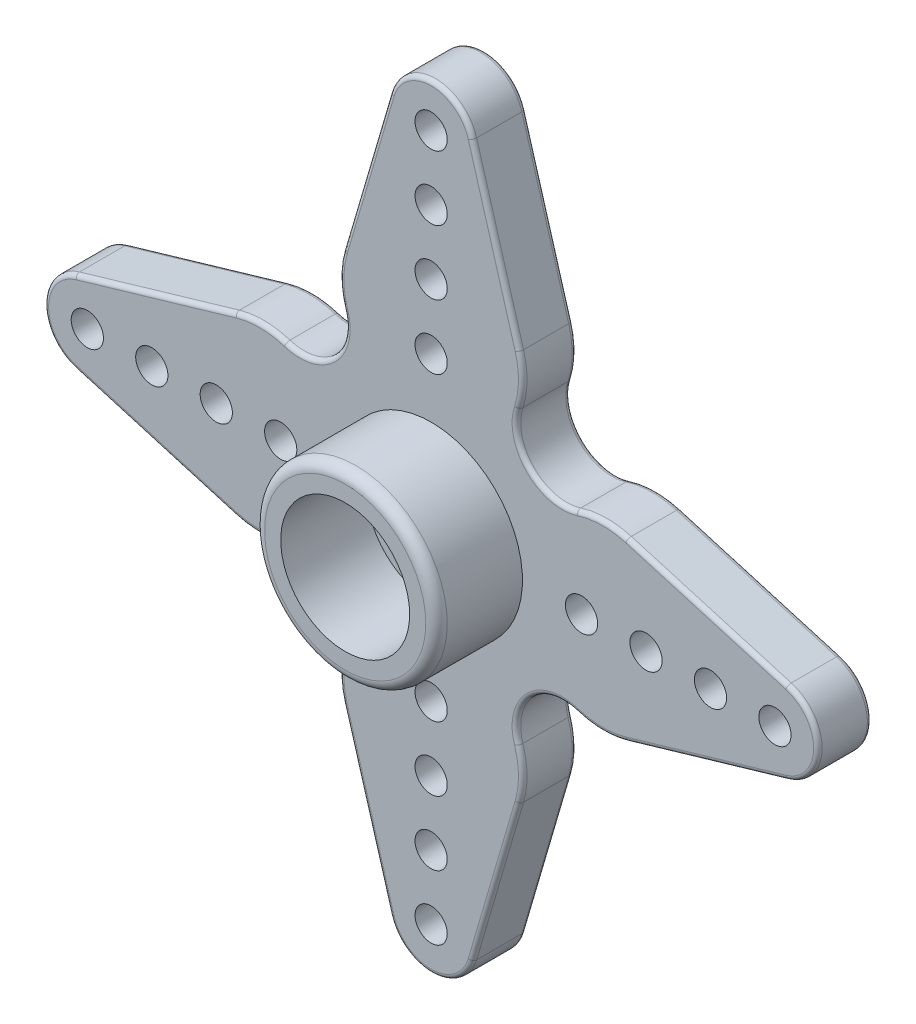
SolidWorks part; units mm, degrees
ref_plane "Front Plane" through (0, 0, 0) normal (0, 0, 1) x (1, 0, 0)
ref_plane "Top Plane" through (0, 0, 0) normal (0, 1, 0) x (1, 0, 0)
ref_plane "Right Plane" through (0, 0, 0) normal (1, 0, 0) x (0, 0, -1)
sketch "Sketch1" plane through (0, 0, 0) normal (0, 0, 1) x (1, 0, 0)
  line L0 (0, 18) -> (0, -18) construction
  line L1 (-18, 18) -> (18, 18) construction
  line L2 (-18, 18) -> (-18, -18) construction
  line L3 (-18, -18) -> (18, -18) construction
  line L4 (18, 18) -> (18, -18) construction
  line L5 (1.9193, 16.5625) -> (4.1016, 9.1164)
  line L6 (-1.9193, 16.5625) -> (-4.1016, 9.1164)
  line L7 (16.5625, 1.9193) -> (9.1164, 4.1016)
  line L8 (16.5625, -1.9193) -> (9.1164, -4.1016)
  line L9 (1.9193, -16.5625) -> (4.1016, -9.1164)
  line L10 (-1.9193, -16.5625) -> (-4.1016, -9.1164)
  line L11 (-16.5625, -1.9193) -> (-9.1164, -4.1016)
  line L12 (-16.5625, 1.9193) -> (-9.1164, 4.1016)
  arc A0 (1.9193, 16.5625) -> (-1.9193, 16.5625) centre (0, 16) ccw
  arc A1 (16.5625, -1.9193) -> (16.5625, 1.9193) centre (16, 0) ccw
  arc A2 (-1.9193, -16.5625) -> (1.9193, -16.5625) centre (0, -16) ccw
  arc A3 (-16.5625, 1.9193) -> (-16.5625, -1.9193) centre (-16, 0) ccw
  circle A4 centre (0, 0) radius 6.5 construction
  circle A5 centre (0, 0) radius 9 construction
  arc A6 (4.0712, 6.7676) -> (6.7676, 4.0712) centre (6.1118, 6.1118) ccw
  arc A7 (6.7676, -4.0712) -> (4.0712, -6.7676) centre (6.1118, -6.1118) ccw
  arc A8 (-4.0712, -6.7676) -> (-6.7676, -4.0712) centre (-6.1118, -6.1118) ccw
  arc A9 (-6.7676, 4.0712) -> (-4.0712, 6.7676) centre (-6.1118, 6.1118) ccw
  arc A10 (-9.1164, 4.1016) -> (-6.7676, 4.0712) centre (-7.9914, 0.263) cw
  arc A11 (-4.1016, -9.1164) -> (-4.0712, -6.7676) centre (-0.263, -7.9914) cw
  arc A12 (4.1016, -9.1164) -> (4.0712, -6.7676) centre (0.263, -7.9914) ccw
  arc A13 (4.1016, 9.1164) -> (4.0712, 6.7676) centre (0.263, 7.9914) cw
  arc A14 (-4.1016, 9.1164) -> (-4.0712, 6.7676) centre (-0.263, 7.9914) ccw
  arc A15 (-9.1164, -4.1016) -> (-6.7676, -4.0712) centre (-7.9914, -0.263) ccw
  arc A16 (9.1164, 4.1016) -> (6.7676, 4.0712) centre (7.9914, 0.263) ccw
  arc A17 (9.1164, -4.1016) -> (6.7676, -4.0712) centre (7.9914, -0.263) cw
  circle A18 centre (0, 7) radius 0.75
  circle A19 centre (0, 10) radius 0.75
  circle A20 centre (0, 13) radius 0.75
  circle A21 centre (0, 16) radius 0.75
  circle A22 centre (0, 0) radius 1.5
  circle A23 centre (16, 0) radius 0.75
  circle A24 centre (13, 0) radius 0.75
  circle A25 centre (10, 0) radius 0.75
  circle A26 centre (7, 0) radius 0.75
  circle A27 centre (0, -16) radius 0.75
  circle A28 centre (0, -13) radius 0.75
  circle A29 centre (0, -10) radius 0.75
  circle A30 centre (0, -7) radius 0.75
  circle A31 centre (-16, 0) radius 0.75
  circle A32 centre (-13, 0) radius 0.75
  circle A33 centre (-10, 0) radius 0.75
  circle A34 centre (-7, 0) radius 0.75
  point P18 (0, 0)
  point P38 (0, 0)
  point P47 (0, 0)
  point P89 (0, 0)
  dimension "D2" = 4
  dimension "D4" = 13
  dimension "D5" = 18
  dimension "D8" = 4
  dimension "D9" = 7
  dimension "D10" = 1.5
  dimension "D11" = 10
  dimension "D12" = 13
  dimension "D13" = 16
  dimension "D14" = 3
  dimension "D1" = 36
  dimension "D3" = 4
  dimension "D6" = 4
  dimension "D7" = 4
  dimension "D15" = 4
extrude "Boss-Extrude1" add sketch "Sketch1" along normal blind 2.5
sketch "Sketch2" plane through (0, 0, 2.5) normal (0, 0, 1) x (1, 0, 0)
  circle A0 centre (0, 0) radius 4.25
  circle A1 centre (0, 0) radius 3
  dimension "D1" = 8.5
  dimension "D2" = 6
extrude "Boss-Extrude2" add sketch "Sketch2" along normal blind 4
sketch "Sketch3" plane through (0, 0, 0) normal (0, 0, -1) x (-1, 0, 0)
  circle A0 centre (0, 0) radius 4.5
  dimension "D1" = 9
extrude "Cut-Extrude1" cut sketch "Sketch3" against normal blind 0.8
sketch "Sketch4" plane through (0, 0, 0.8) normal (0, 0, -1) x (-1, 0, 0)
  circle A0 centre (0, 0) radius 3.5
  circle A1 centre (0, 0) radius 3.7
  dimension "D1" = 7
  dimension "D2" = 0.2
extrude "Boss-Extrude3" add sketch "Sketch4" along normal blind 1
fillet "Fillet2" radius 0.5 1 edges at (4.25, 0, 6.5)
fillet "Fillet3" radius 0.2 48 edges at (4.2627, 7.9397, 2.5) (4.5962, 4.5962, 2.5) (7.9397, 4.2627, 2.5) (12.8395, 3.0104, 2.5) (18, 0, 2.5) (12.8395, -3.0104, 2.5) (7.9397, -4.2627, 2.5) (4.5962, -4.5962, 2.5) (4.2627, -7.9397, 2.5) (3.0104, -12.8395, 2.5) (0, -18, 2.5) (-3.0104, -12.8395, 2.5) (-4.2627, -7.9397, 2.5) (-4.5962, -4.5962, 2.5) (-7.9397, -4.2627, 2.5) (-12.8395, -3.0104, 2.5) (-18, 0, 2.5) (-12.8395, 3.0104, 2.5) (-7.9397, 4.2627, 2.5) (-4.5962, 4.5962, 2.5) (-4.2627, 7.9397, 2.5) (-3.0104, 12.8395, 2.5) (0, 18, 2.5) (4.2627, 7.9397, 0) (4.5962, 4.5962, 0) (7.9397, 4.2627, 0) (12.8395, 3.0104, 0) (18, 0, 0) (12.8395, -3.0104, 0) (7.9397, -4.2627, 0) (4.5962, -4.5962, 0) (4.2627, -7.9397, 0) (3.0104, -12.8395, 0) (0, -18, 0) (-3.0104, -12.8395, 0) (-4.2627, -7.9397, 0) (-4.5962, -4.5962, 0) (-7.9397, -4.2627, 0) (-12.8395, -3.0104, 0) (-18, 0, 0) (-12.8395, 3.0104, 0) (-7.9397, 4.2627, 0) (-4.5962, 4.5962, 0) (-4.2627, 7.9397, 0) (-3.0104, 12.8395, 0) (0, 18, 0) (3.0104, 12.8395, 2.5) (3.0104, 12.8395, 0)
